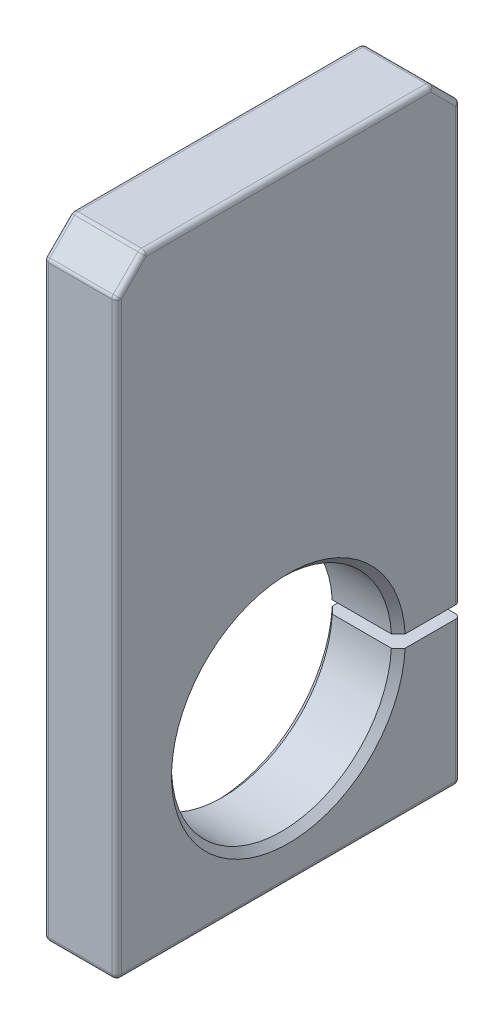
SolidWorks part; units mm, degrees
ref_plane "Face" through (0, 0, 0) normal (0, 0, 1) x (1, 0, 0)
ref_plane "Dessus" through (0, 0, 0) normal (0, 1, 0) x (1, 0, 0)
ref_plane "Droite" through (0, 0, 0) normal (1, 0, 0) x (0, 0, -1)
sketch "Esquisse1" plane through (0, 0, 0) normal (1, 0, 0) x (0, 0, -1)
  line L0 (0, 37.762) -> (0, -24.066) construction
  line L1 (-20.3485, 0) -> (16.044, 0) construction
  line L2 (7.9873, 0.45) -> (12.5, 0.45)
  line L3 (-12.5, 34) -> (12.5, 34)
  line L4 (-12.5, 34) -> (-12.5, -11)
  line L5 (-12.5, -11) -> (12.5, -11)
  line L6 (12.5, 34) -> (12.5, 0.45)
  line L7 (7.9873, -0.45) -> (12.5, -0.45)
  line L8 (12.5, -0.45) -> (12.5, -11)
  arc A0 (7.9873, 0.45) -> (7.9873, -0.45) centre (0, 0) ccw
  dimension "D3" = 16
  dimension "D4" = 11
  dimension "D1" = 25
  dimension "D2" = 45
  dimension "D5" = 0.9
extrude "Base-Extrusion" add sketch "Esquisse1" against normal mid plane 5.3
chamfer "Chanfrein1" distance 2 angle 45 2 edges at (0, 34, 12.5) (0, 34, -12.5)
chamfer "Chanfrein2" distance 0.5 angle 45 2 edges at (-2.65, 0, 8) (2.65, 0, 8)
fillet "Congé1" radius 0.35 20 edges at (-2.65, -5.725, -12.5) (2.65, -11, 0) (0, -11, -12.5) (0, -11, 12.5) (-2.65, 16.225, -12.5) (2.65, 34, 0) (-2.65, 34, 0) (0, 34, -10.5) (0, 34, 10.5) (2.65, 10.5, 12.5) (2.65, 33, -11.5) (2.65, 33, 11.5) (-2.65, 10.5, 12.5) (0, 32, 12.5) (-2.65, 33, -11.5) (-2.65, 33, 11.5) (0, 32, -12.5) (-2.65, -11, 0) (2.65, 16.225, -12.5) (2.65, -5.725, -12.5)
sketch "Esquisse2" plane through (0, -11, 0) normal (0, -1, 0) x (1, 0, 0)
  line L0 (0, 1.7507) -> (0, -13.3831) construction
  line L1 (4.2772, -10.2437) -> (-4.2772, -10.2437) construction
  line L2 (-2.15, -7.9873) -> (2.15, -7.9873) construction
  line L3 (2.3, -12.5) -> (-2.3, -12.5) construction
  circle A0 centre (0, -10.2437) radius 1.25
  dimension "D1" = 2.5
extrude "Enlèv. mat.-Extru.1" cut sketch "Esquisse2" against normal up to surface (10.55 mm away)
sketch "Esquisse3" plane through (0, 0.45, 0) normal (0, -1, 0) x (1, 0, 0)
  circle A0 centre (0, -10.2437) radius 0.875
  circle A1 centre (0, -10.2437) radius 1.25 construction
  dimension "D1" = 1.75
extrude "Enlèv. mat.-Extru.2" cut sketch "Esquisse3" against normal blind 7
